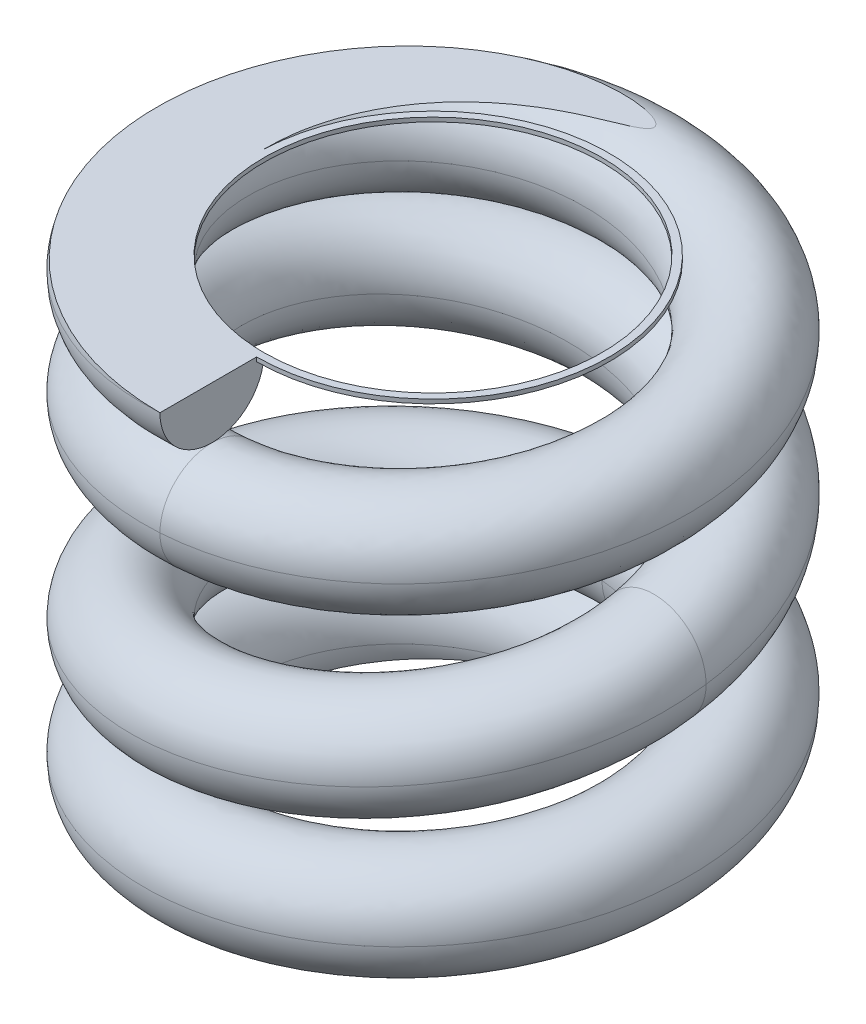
SolidWorks part; units mm, degrees
ref_plane "Front Plane" through (0, 0, 0) normal (0, 0, 1) x (1, 0, 0)
ref_plane "Top Plane" through (0, 0, 0) normal (0, 1, 0) x (1, 0, 0)
ref_plane "Right Plane" through (0, 0, 0) normal (1, 0, 0) x (0, 0, -1)
imported_body "Imported1"
sketch "Sketch1" plane through (0, 14.351, 0) normal (0, 1, 0) x (1, 0, 0)
  circle A0 centre (0, 0) radius 10.3121
  circle A1 centre (0, 0) radius 10.7628
  dimension "D1" = 21.5256
extrude "Boss-Extrude1" add sketch "Sketch1" against normal blind 0.254
